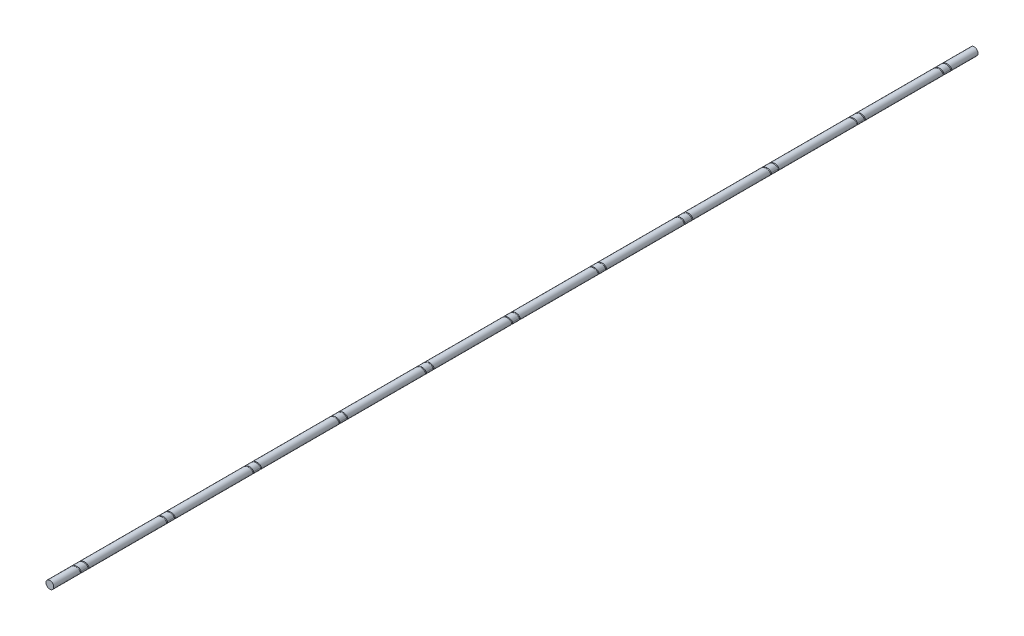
SolidWorks part; units mm, degrees
ref_plane "Front Plane" through (0, 0, 0) normal (0, 0, 1) x (1, 0, 0)
ref_plane "Top Plane" through (0, 0, 0) normal (0, 1, 0) x (1, 0, 0)
ref_plane "Right Plane" through (0, 0, 0) normal (1, 0, 0) x (0, 0, -1)
sketch "Sketch1" plane through (0, 0, 0) normal (0, 0, 1) x (1, 0, 0)
  circle A0 centre (0, 0) radius 25
  dimension "D1" = 50
extrude "Boss-Extrude1" add sketch "Sketch1" along normal blind 6000
ref_plane "Plane1" through (0, 0, 150) normal (0, 0, 1) x (1, 0, 0)
sketch "Sketch2" plane through (0, 0, 150) normal (0, 0, 1) x (1, 0, 0)
  circle A0 centre (0, 0) radius 27.646
  dimension "D1" = 55.292
curve "Helix/Spiral1"
sketch "Sketch3" plane through (0, 0, 0) normal (0, 1, 0) x (1, 0, 0)
  circle A0 centre (-27.646, -150) radius 3.969
  spline S0 degree 3 poles (-27.646, -150) (-27.646, -150.7073) (-26.9833, -152.1286) (-24.0718, -154.2551) (-19.4496, -156.383) (-13.4454, -158.5106) (-6.4857, -160.6383) (0.9349, -162.766) (8.289, -164.8936) (15.0541, -167.0213) (20.7495, -169.1489) (24.9703, -171.2766) (27.4167, -173.4043) (27.9149, -175.5319) (26.4293, -177.6596) (23.0657, -179.7872) (18.063, -181.9149) (11.7766, -184.0426) (4.6535, -186.1702) (-2.8004, -188.2979) (-10.0553, -190.4255) (-16.5956, -192.5532) (-21.9566, -194.6809) (-25.7573, -196.8085) (-27.7277, -198.9362) (-27.7277, -201.0638) (-25.7573, -203.1915) (-21.9566, -205.3191) (-16.5956, -207.4468) (-10.0553, -209.5745) (-2.8004, -211.7021) (4.6535, -213.8298) (11.7766, -215.9574) (18.063, -218.0851) (23.0657, -220.2128) (26.4293, -222.3404) (27.9149, -224.4681) (27.4167, -226.5957) (24.9703, -228.7234) (20.7495, -230.8511) (15.0541, -232.9787) (8.289, -235.1064) (0.9349, -237.234) (-6.4857, -239.3617) (-13.4454, -241.4894) (-19.4496, -243.617) (-24.0718, -245.7449) (-26.9833, -247.8714) (-27.646, -249.2927) (-27.646, -250) knots 0 0 0 0 0.021277 0.042553 0.06383 0.085106 0.106383 0.12766 0.148936 0.170213 0.191489 0.212766 0.234043 0.255319 0.276596 0.297872 0.319149 0.340426 0.361702 0.382979 0.404255 0.425532 0.446809 0.468085 0.489362 0.510638 0.531915 0.553191 0.574468 0.595745 0.617021 0.638298 0.659574 0.680851 0.702128 0.723404 0.744681 0.765957 0.787234 0.808511 0.829787 0.851064 0.87234 0.893617 0.914894 0.93617 0.957447 0.978723 1 1 1 1 construction
  dimension "D1" = 7.938
sweep "Cut-Sweep1" cut profiles "Sketch3" path "Helix/Spiral1"
pattern_linear "LPattern1" count 11 spacing 560 along (0, 0, -1) of "Cut-Sweep1"
